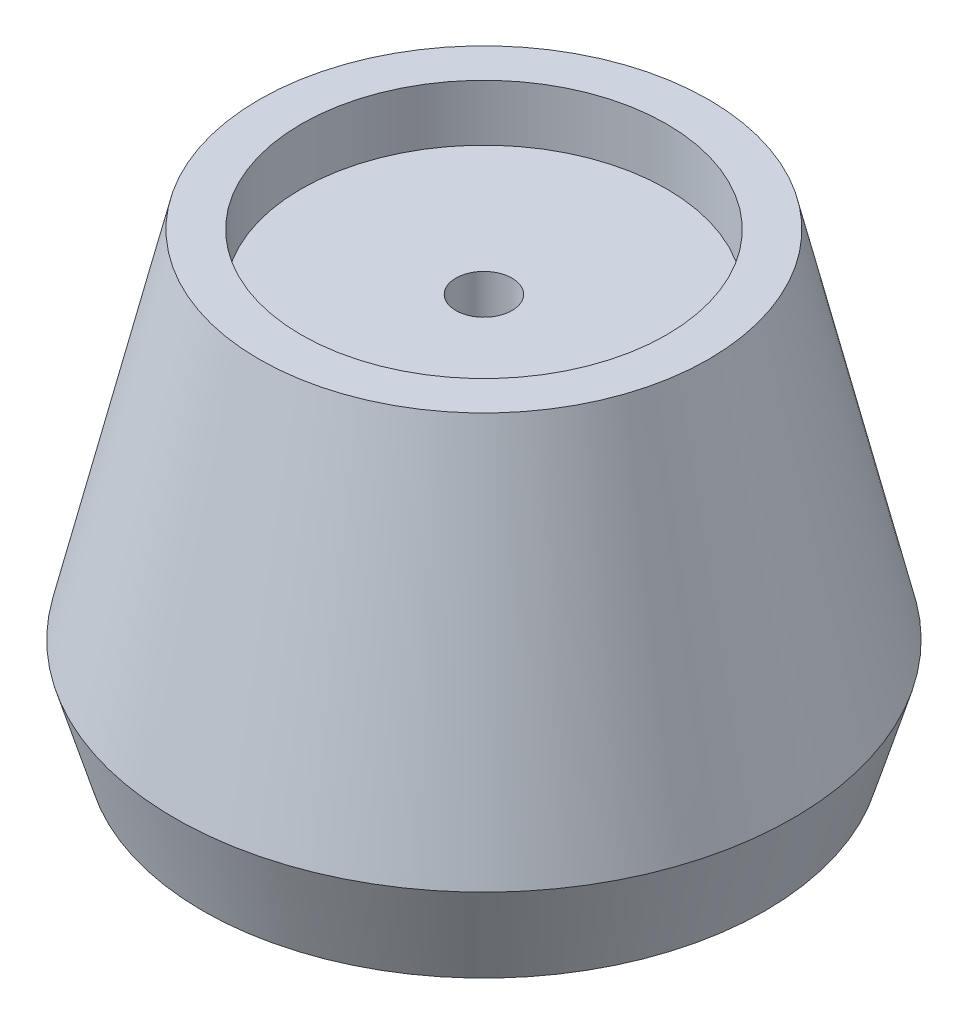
SolidWorks part; units mm, degrees
ref_plane "Front Plane" through (0, 0, 0) normal (0, 0, 1) x (1, 0, 0)
ref_plane "Top Plane" through (0, 0, 0) normal (0, 1, 0) x (1, 0, 0)
ref_plane "Right Plane" through (0, 0, 0) normal (1, 0, 0) x (0, 0, -1)
sketch "Sketch22" plane through (0, 0, 0) normal (0, 0, 1) x (1, 0, 0)
  line L0 (0, 0) -> (0, 101.6)
  line L1 (0, 101.6) -> (50.8, 101.6)
  line L2 (50.8, 101.6) -> (69.85, 21.3022)
  line L3 (69.85, 21.3022) -> (63.5, 0)
  line L4 (63.5, 0) -> (0, 0)
  dimension "D1" = 50.8
  dimension "D2" = 69.85
  dimension "D3" = 6.35
  dimension "D4" = 101.6
revolve "Revolve2" add sketch "Sketch22" angle 360 about L0
sketch "Sketch23" plane through (0, 101.6, 0) normal (0, 1, 0) x (1, 0, 0)
  circle A0 centre (0, 0) radius 41.275
  dimension "D1" = 82.55
extrude "Cut-Extrude3" cut sketch "Sketch23" against normal blind 12.7
sketch "Sketch24" plane through (0, 101.6, 0) normal (0, 1, 0) x (1, 0, 0)
  circle A0 centre (0, 0) radius 6.35
  dimension "D1" = 12.7
extrude "Cut-Extrude4" cut sketch "Sketch24" against normal blind 152.4
sketch "Sketch25" plane through (0, 0, 0) normal (0, -1, 0) x (1, 0, 0)
  circle A0 centre (0, 0) radius 57.15
  dimension "D1" = 114.3
extrude "Cut-Extrude5" cut sketch "Sketch25" against normal blind 6.35
